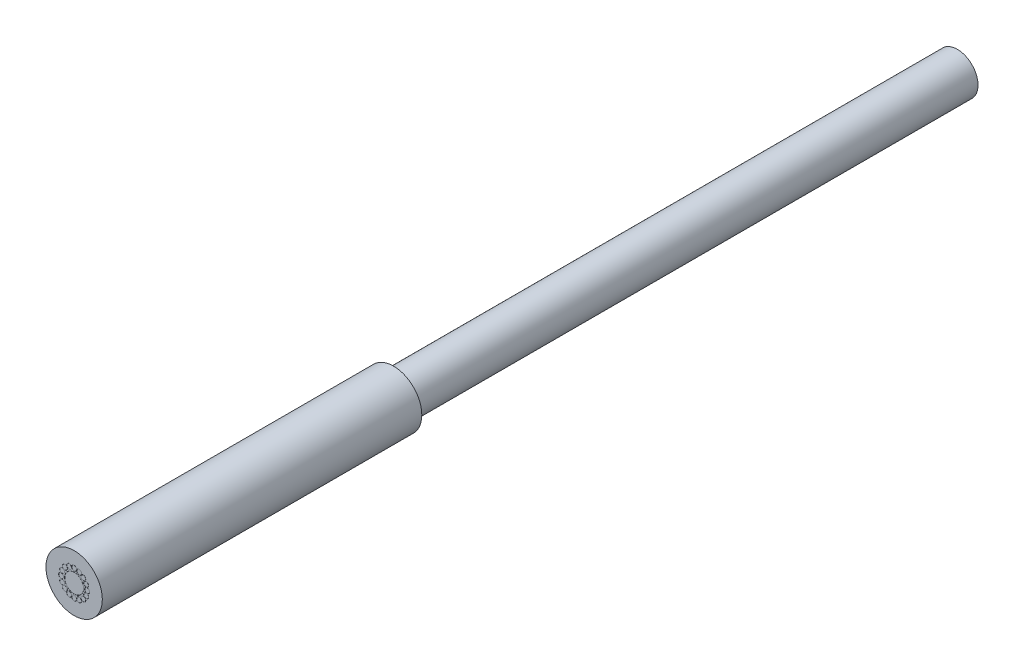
SolidWorks part; units mm, degrees
ref_plane "前视基准面" through (0, 0, 0) normal (0, 0, 1) x (1, 0, 0)
ref_plane "上视基准面" through (0, 0, 0) normal (0, 1, 0) x (1, 0, 0)
ref_plane "右视基准面" through (0, 0, 0) normal (1, 0, 0) x (0, 0, -1)
sketch "草图1" plane through (0, 0, 0) normal (0, 0, 1) x (1, 0, 0)
  circle A0 centre (0, 0) radius 1.5
  dimension "D1" = 3
extrude "凸台-拉伸1" add sketch "草图1" against normal blind 17
sketch "草图2" plane through (0, 0, -17) normal (0, 0, -1) x (-1, 0, 0)
  circle A0 centre (0, 0) radius 1.1
  dimension "D1" = 2.2
extrude "凸台-拉伸2" add sketch "草图2" along normal blind 30
sketch "草图3" plane through (0, 0, 0) normal (0, 0, 1) x (1, 0, 0)
  line L0 (-1000, 0) -> (49000, 0) construction
  circle A0 centre (0, 0) radius 0.505
  circle A1 centre (0, 0) radius 0.5
  circle A2 centre (0, 0.692) radius 0.125
  circle A3 centre (0, 0.692) radius 0.13
  circle A4 centre (0.2648, 0.6393) radius 0.13
  circle A5 centre (0.2648, 0.6393) radius 0.125
  circle A6 centre (0.4893, 0.4893) radius 0.13
  circle A7 centre (0.4893, 0.4893) radius 0.125
  circle A8 centre (0.6393, 0.2648) radius 0.13
  circle A9 centre (0.6393, 0.2648) radius 0.125
  circle A10 centre (0.692, 0) radius 0.13
  circle A11 centre (0.692, 0) radius 0.125
  circle A12 centre (0.6393, -0.2648) radius 0.13
  circle A13 centre (0.6393, -0.2648) radius 0.125
  circle A14 centre (0.4893, -0.4893) radius 0.13
  circle A15 centre (0.4893, -0.4893) radius 0.125
  circle A16 centre (0.2648, -0.6393) radius 0.13
  circle A17 centre (0.2648, -0.6393) radius 0.125
  circle A18 centre (0, -0.692) radius 0.13
  circle A19 centre (0, -0.692) radius 0.125
  circle A20 centre (-0.2648, -0.6393) radius 0.13
  circle A21 centre (-0.2648, -0.6393) radius 0.125
  circle A22 centre (-0.4893, -0.4893) radius 0.13
  circle A23 centre (-0.4893, -0.4893) radius 0.125
  circle A24 centre (-0.6393, -0.2648) radius 0.13
  circle A25 centre (-0.6393, -0.2648) radius 0.125
  circle A26 centre (-0.692, 0) radius 0.13
  circle A27 centre (-0.692, 0) radius 0.125
  circle A28 centre (-0.6393, 0.2648) radius 0.13
  circle A29 centre (-0.6393, 0.2648) radius 0.125
  circle A30 centre (-0.4893, 0.4893) radius 0.13
  circle A31 centre (-0.4893, 0.4893) radius 0.125
  circle A32 centre (-0.2648, 0.6393) radius 0.13
  circle A33 centre (-0.2648, 0.6393) radius 0.125
  point P7 (0, 0)
  point P8 (0, 0.6865)
  dimension "D1" = 1
  dimension "D2" = 1.01
  dimension "D3" = 0.25
  dimension "D4" = 0.26
  dimension "D6" = 0.01
  dimension "D5" = 16
extrude "切除-拉伸1" cut sketch "草图3" against normal blind 0.1
